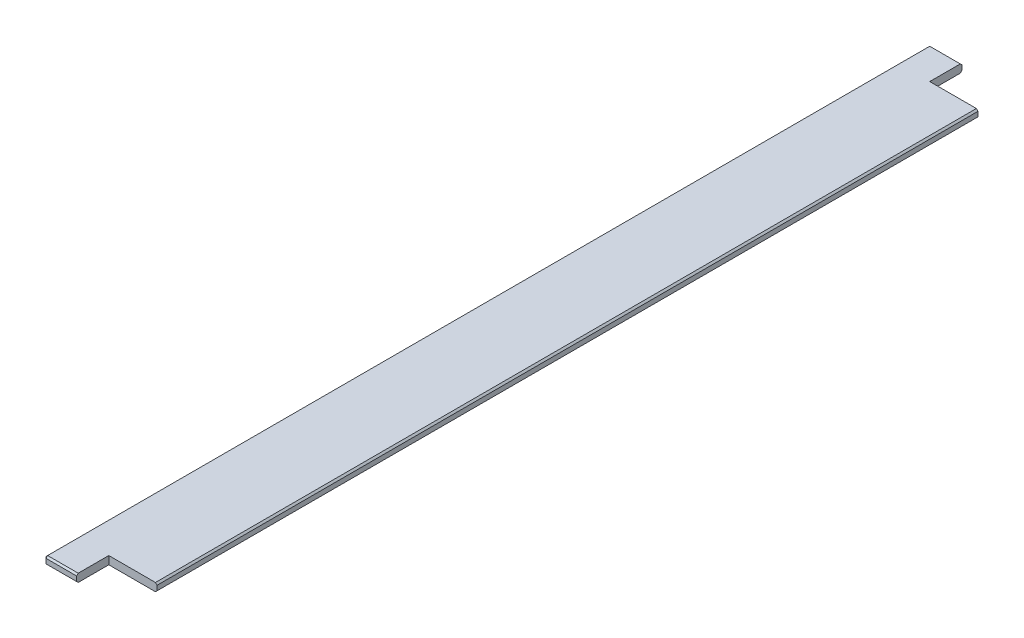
SolidWorks part; units mm, degrees
ref_plane "Plan de face" through (0, 0, 0) normal (0, 0, 1) x (1, 0, 0)
ref_plane "Plan de dessus" through (0, 0, 0) normal (0, 1, 0) x (1, 0, 0)
ref_plane "Plan de droite" through (0, 0, 0) normal (1, 0, 0) x (0, 0, -1)
sketch "Esquisse1" plane through (0, 0, 0) normal (0, 0, 1) x (1, 0, 0)
  line L0 (50, -5) -> (-50, 5) construction
  line L2 (50, -5) -> (-50, -5)
  line L3 (50, -5) -> (50, 5)
  line L4 (50, 5) -> (-50, 5)
  line L5 (-50, -5) -> (-50, 5)
  dimension "D1" = 10
  dimension "D2" = 100
extrude "Boss.-Extru.1" add sketch "Esquisse1" along normal mid plane 1100
chamfer "Chanfrein1" distance 2 angle 45 12 edges at (-50, 0, -550) (50, 0, -550) (-50, -5, 0) (0, -5, -550) (50, -5, 0) (0, -5, 550) (-50, 0, 550) (50, 0, 550) (50, 5, 0) (0, 5, 550) (-50, 5, 0) (0, 5, -550)
sketch "Esquisse2" plane through (0, 5, 0) normal (0, 1, 0) x (1, 0, 0)
  line L0 (50, 548) -> (50, -548) construction
  line L1 (50, -510) -> (-10, -510)
  line L2 (50, -510) -> (50, -550)
  line L3 (50, -550) -> (-10, -550)
  line L4 (-10, -510) -> (-10, -550)
  line L5 (48, -550) -> (-48, -550) construction
  line L6 (-48, 550) -> (48, 550) construction
  line L7 (50, 510) -> (-10, 510)
  line L8 (50, 510) -> (50, 550)
  line L9 (50, 550) -> (-10, 550)
  line L10 (-10, 510) -> (-10, 550)
  dimension "D1" = 40
  dimension "D2" = 60
  dimension "D3" = 40
  dimension "D4" = 60
extrude "Enlèv. mat.-Extru.1" cut sketch "Esquisse2" against normal through all
